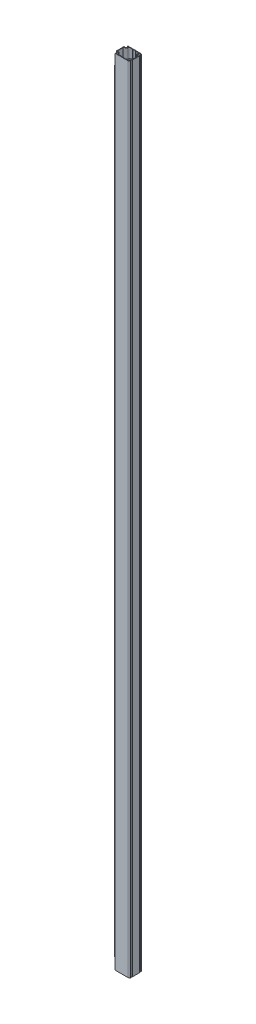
SolidWorks part; units mm, degrees
ref_plane "Alzado" through (0, 0, 0) normal (0, 0, 1) x (1, 0, 0)
ref_plane "Planta" through (0, 0, 0) normal (0, 1, 0) x (1, 0, 0)
ref_plane "Vista lateral" through (0, 0, 0) normal (1, 0, 0) x (0, 0, -1)
sketch "Croquis2" plane through (0, 0, 0) normal (0, 1, 0) x (1, 0, 0)
  line L0 (23.3364, 30.5) -> (62.311, 30.5) construction
  line L1 (40.5, 40) -> (-40.5, 40)
  line L2 (50, 21.5557) -> (50, -21.5557)
  line L5 (0, -51.871) -> (0, 72.2531) construction
  line L6 (-11, 35.5) -> (-8, 35.5)
  line L11 (-8, 35.5) -> (-6.5, 37)
  line L12 (-11, 35.5) -> (-12.5, 37)
  line L13 (40.5, 16.2383) -> (40.5, 49.0687) construction
  line L14 (24.5, 37) -> (12.5, 37)
  line L15 (47, 14.5) -> (47, -14.5)
  line L16 (11, 35.5) -> (12.5, 37)
  line L17 (8, 35.5) -> (6.5, 37)
  line L19 (11, 35.5) -> (8, 35.5)
  line L20 (-59.3231, 0) -> (58.6433, 0) construction
  line L21 (40.5, -16.2383) -> (40.5, -49.0687) construction
  line L22 (23.3364, -30.5) -> (62.311, -30.5) construction
  line L23 (24.5, -37) -> (12.5, -37)
  line L24 (40.5, -40) -> (-40.5, -40)
  line L26 (-23.3364, -30.5) -> (-62.311, -30.5) construction
  line L27 (-40.5, -16.2383) -> (-40.5, -49.0687) construction
  line L28 (-12.5, 37) -> (-24.5, 37)
  line L29 (6.5, 37) -> (-6.5, 37)
  line L30 (-40.5, 16.2383) -> (-40.5, 49.0687) construction
  line L31 (-8, -35.5) -> (-6.5, -37)
  line L32 (-11, -35.5) -> (-8, -35.5)
  line L33 (-11, -35.5) -> (-12.5, -37)
  line L34 (11, -35.5) -> (12.5, -37)
  line L35 (-23.3364, 30.5) -> (-62.311, 30.5) construction
  line L36 (-47, 14.5) -> (-47, -14.5)
  line L37 (-50, 21.5557) -> (-50, -21.5557)
  line L38 (11, -35.5) -> (8, -35.5)
  line L39 (8, -35.5) -> (6.5, -37)
  line L40 (-12.5, -37) -> (-24.5, -37)
  line L41 (6.5, -37) -> (-6.5, -37)
  arc A0 (49.7425, 32.697) -> (40.5, 40) centre (40.5, 30.5) ccw
  arc A1 (46.8238, 32.0032) -> (43.9048, 24.9631) centre (40.5, 30.5) ccw
  arc A2 (31, 30.5) -> (24.5, 37) centre (24.5, 30.5) ccw
  arc A3 (47, 14.5) -> (40.5, 21) centre (40.5, 14.5) ccw
  arc A9 (46.8238, 32.0032) -> (49.7425, 32.697) centre (48.2831, 32.3501) ccw
  arc A10 (50, 21.5557) -> (43.9048, 24.9631) centre (46, 21.5557) ccw
  arc A11 (50, -21.5557) -> (43.9048, -24.9631) centre (46, -21.5557) cw
  arc A12 (46.8238, -32.0032) -> (49.7425, -32.697) centre (48.2831, -32.3501) cw
  arc A13 (47, -14.5) -> (40.5, -21) centre (40.5, -14.5) cw
  arc A14 (31, -30.5) -> (24.5, -37) centre (24.5, -30.5) cw
  arc A15 (46.8238, -32.0032) -> (43.9048, -24.9631) centre (40.5, -30.5) cw
  arc A16 (49.7425, -32.697) -> (40.5, -40) centre (40.5, -30.5) cw
  arc A17 (-49.7425, -32.697) -> (-40.5, -40) centre (-40.5, -30.5) ccw
  arc A18 (-46.8238, -32.0032) -> (-43.9048, -24.9631) centre (-40.5, -30.5) ccw
  arc A19 (-31, -30.5) -> (-24.5, -37) centre (-24.5, -30.5) ccw
  arc A20 (-47, -14.5) -> (-40.5, -21) centre (-40.5, -14.5) ccw
  arc A21 (-46.8238, -32.0032) -> (-49.7425, -32.697) centre (-48.2831, -32.3501) ccw
  arc A22 (-50, -21.5557) -> (-43.9048, -24.9631) centre (-46, -21.5557) ccw
  arc A23 (-50, 21.5557) -> (-43.9048, 24.9631) centre (-46, 21.5557) cw
  arc A24 (-46.8238, 32.0032) -> (-49.7425, 32.697) centre (-48.2831, 32.3501) cw
  arc A25 (-47, 14.5) -> (-40.5, 21) centre (-40.5, 14.5) cw
  arc A26 (-31, 30.5) -> (-24.5, 37) centre (-24.5, 30.5) cw
  arc A27 (-46.8238, 32.0032) -> (-43.9048, 24.9631) centre (-40.5, 30.5) cw
  arc A28 (-49.7425, 32.697) -> (-40.5, 40) centre (-40.5, 30.5) cw
  arc A29 (31, 30.5) -> (40.5, 21) centre (40.5, 30.5) ccw
  arc A30 (-31, 30.5) -> (-40.5, 21) centre (-40.5, 30.5) cw
  arc A31 (31, -30.5) -> (40.5, -21) centre (40.5, -30.5) cw
  arc A32 (-31, -30.5) -> (-40.5, -21) centre (-40.5, -30.5) ccw
  point P29 (50, 0)
  point P53 (47, 0)
  point P54 (0, 37)
  point P55 (0, -37)
  point P56 (-47, 0)
  point P92 (0, -40)
  point P93 (0, 40)
  point P94 (-50, 0)
  dimension "D5" = 6.5
  dimension "D6" = 6.5
  dimension "D7" = 9.5
  dimension "D8" = 94
  dimension "D9" = 4
  dimension "D10" = 1.8501
  dimension "D2" = 80
  dimension "D3" = 100
  dimension "D4" = 74
  dimension "D11" = 1.5
  dimension "D12" = 45
  dimension "D13" = 3
  dimension "D14" = 45
  dimension "D15" = 8
extrude "Saliente-Extruir2" add sketch "Croquis2" along normal blind 5000
sketch "Croquis3" plane through (0, 5000, 0) normal (0, 1, 0) x (1, 0, 0)
  line L0 (-40.5, 30.5) -> (-40.5, 40)
  line L1 (-40.5, 40) -> (-52.6148, 40)
  line L2 (-52.6148, 40) -> (-52.6148, 30.5)
  line L3 (-52.6148, 30.5) -> (-40.5, 30.5)
  line L4 (-40.5, -30.5) -> (-54.5829, -30.5)
  line L5 (-54.5829, -30.5) -> (-54.5829, -45.5169)
  line L6 (-54.5829, -45.5169) -> (-40.5, -45.5169)
  line L7 (-40.5, -45.5169) -> (-40.5, -30.5)
extrude "Cortar-Extruir1" cut sketch "Croquis3" against normal blind 70
sketch "Croquis4" plane through (0, 0, 0) normal (0, -1, 0) x (1, 0, 0)
  line L0 (-40.5, -30.5) -> (-56.8369, -30.5)
  line L1 (-56.8369, -30.5) -> (-56.8369, -42.9807)
  line L2 (-56.8369, -42.9807) -> (-40.5, -42.9807)
  line L3 (-40.5, -42.9807) -> (-40.5, -30.5)
  line L4 (-40.5, 30.5) -> (-40.5, 40)
  line L5 (-40.5, 40) -> (-54.7188, 40)
  line L6 (-54.7188, 40) -> (-54.7188, 30.5)
  line L7 (-54.7188, 30.5) -> (-40.5, 30.5)
extrude "Cortar-Extruir2" cut sketch "Croquis4" against normal blind 70
